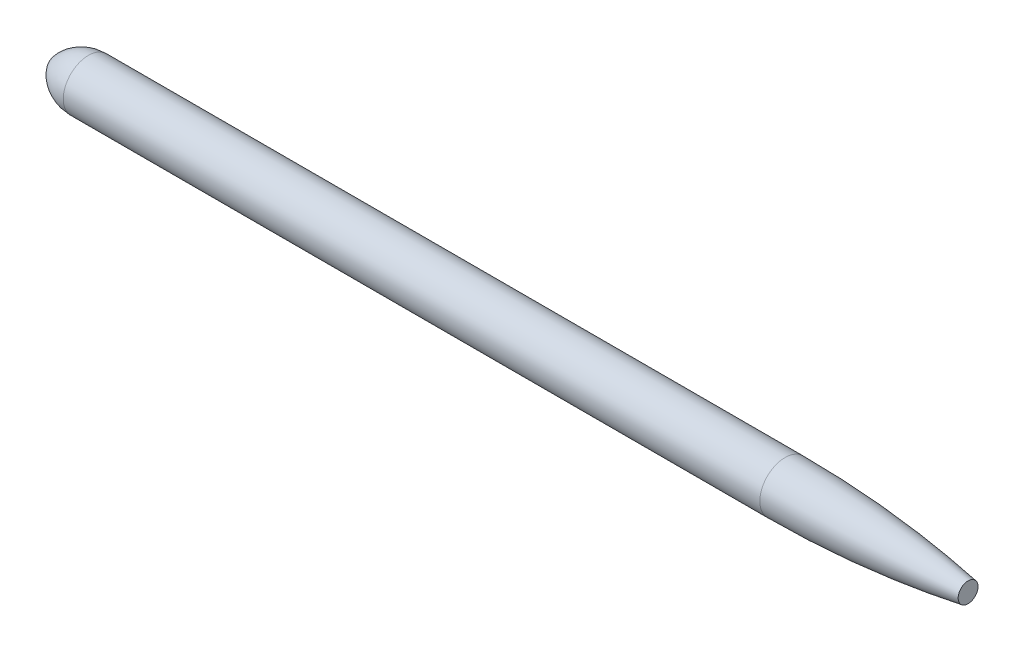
SolidWorks part; units mm, degrees
ref_plane "Front Plane" through (0, 0, 0) normal (0, 0, 1) x (1, 0, 0)
ref_plane "Top Plane" through (0, 0, 0) normal (0, 1, 0) x (1, 0, 0)
ref_plane "Right Plane" through (0, 0, 0) normal (1, 0, 0) x (0, 0, -1)
sketch "rootSketch" plane through (0, 0, 0) normal (0, 1, 0) x (1, 0, 0)
  line L0 (0, 0) -> (12000, 0) construction
  line L1 (270, -177.8) -> (270, 177.8) construction
  line L2 (0, 0) -> (6470, 0)
  line L3 (270, -177.8) -> (5180, -177.8)
  line L4 (6470, -70) -> (6470, 0)
  arc A0 (5180, -177.8) -> (6470, -70) centre (5180, 7594.5601) ccw
  arc A1 (270, -177.8) -> (0, 0) centre (270, 116.1056) cw
  point P5 (270, 0)
revolve "Revolve1" add sketch "rootSketch" angle 360 about L0
ref_plane "Plane1" through (5330, 0, 0) normal (1, 0, 0) x (0, 0, -1)
equation "\"length\"= 6.47"
equation "\"D1@rootSketch\" = \"length\""
equation "\"diameter\"= .3556"
equation "\"rootMaxThickness@rootSketch\"=\"diameter\""
equation "\"LEtaperlength\"= 0.27"
equation "\"TEradius\"= 0.07"
equation "\"D4@rootSketch\"=\"TEradius\""
equation "\"TEtaperlength\"= 1.29"
equation "\"D2@rootSketch\"=\"LEtaperlength\""
equation "\"D3@rootSketch\"=\"TEtaperlength\""
